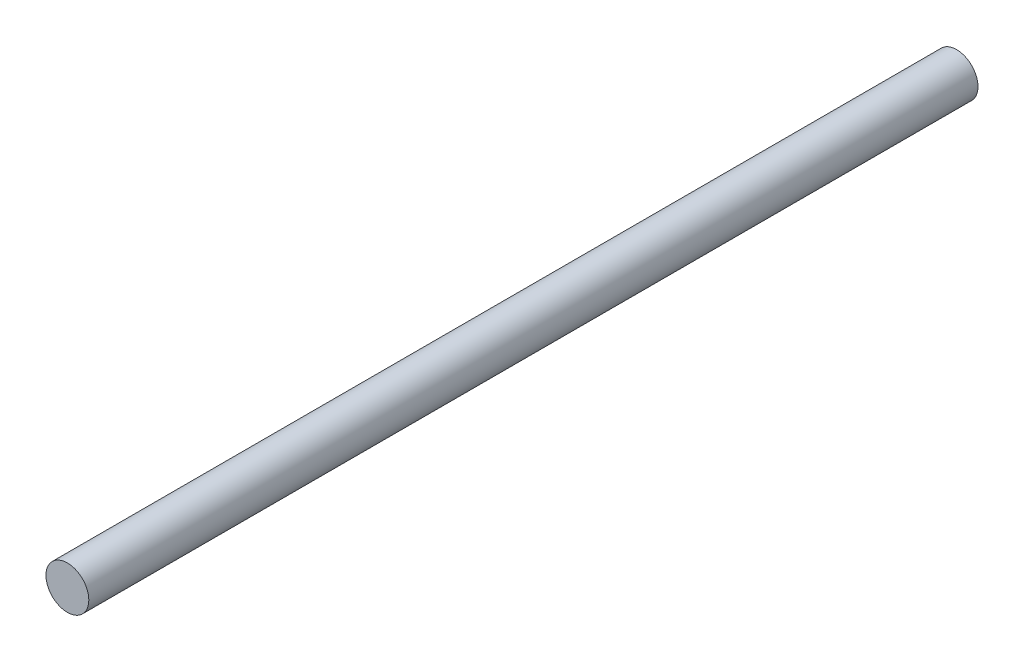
SolidWorks part; units mm, degrees
ref_plane "Face" through (0, 0, 0) normal (0, 0, 1) x (1, 0, 0)
ref_plane "Dessus" through (0, 0, 0) normal (0, 1, 0) x (1, 0, 0)
ref_plane "Droite" through (0, 0, 0) normal (1, 0, 0) x (0, 0, -1)
sketch "Esquisse1" plane through (0, 0, 0) normal (0, 0, 1) x (1, 0, 0)
  circle A0 centre (0, 0) radius 0.4
  dimension "D1" = 0.8
extrude "Extrusion1" add sketch "Esquisse1" along normal blind 16.6
